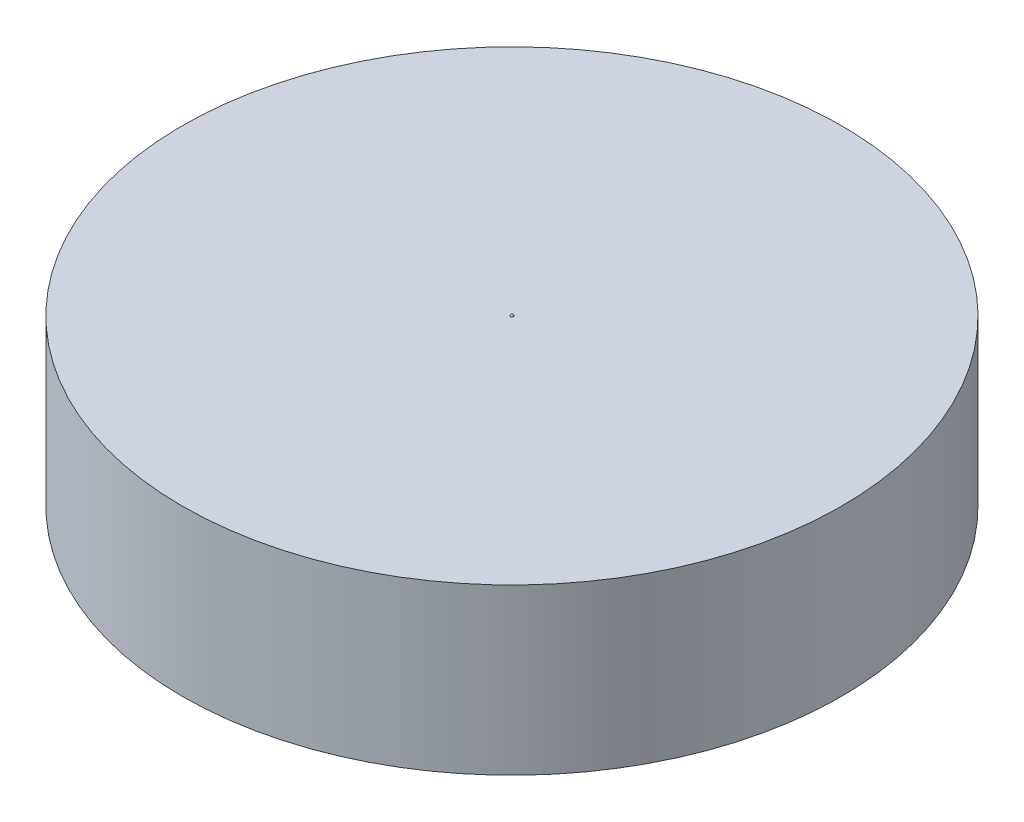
SolidWorks part; units mm, degrees
ref_plane "Ebene vorne" through (0, 0, 0) normal (0, 0, 1) x (1, 0, 0)
ref_plane "Ebene oben" through (0, 0, 0) normal (0, 1, 0) x (1, 0, 0)
ref_plane "Ebene rechts" through (0, 0, 0) normal (1, 0, 0) x (0, 0, -1)
sketch "Skizze1" plane through (0, 0, 0) normal (0, 1, 0) x (1, 0, 0)
  circle A0 centre (0, 0) radius 6
  dimension "D1" = 12
extrude "Linear austragen1" add sketch "Skizze1" against normal blind 3
sketch "Skizze2" plane through (0, 0, 0) normal (0, 0, 1) x (1, 0, 0)
  line L0 (0, 0) -> (0, 0.025)
  line L1 (6, 0) -> (-6, 0) construction
  line L2 (0.025, 0) -> (0, 0)
  arc A0 (0, 0.025) -> (0.025, 0) centre (0, 0) cw
  dimension "D1" = 0.025
revolve "Rotation1" add sketch "Skizze2" angle 360 about L0
